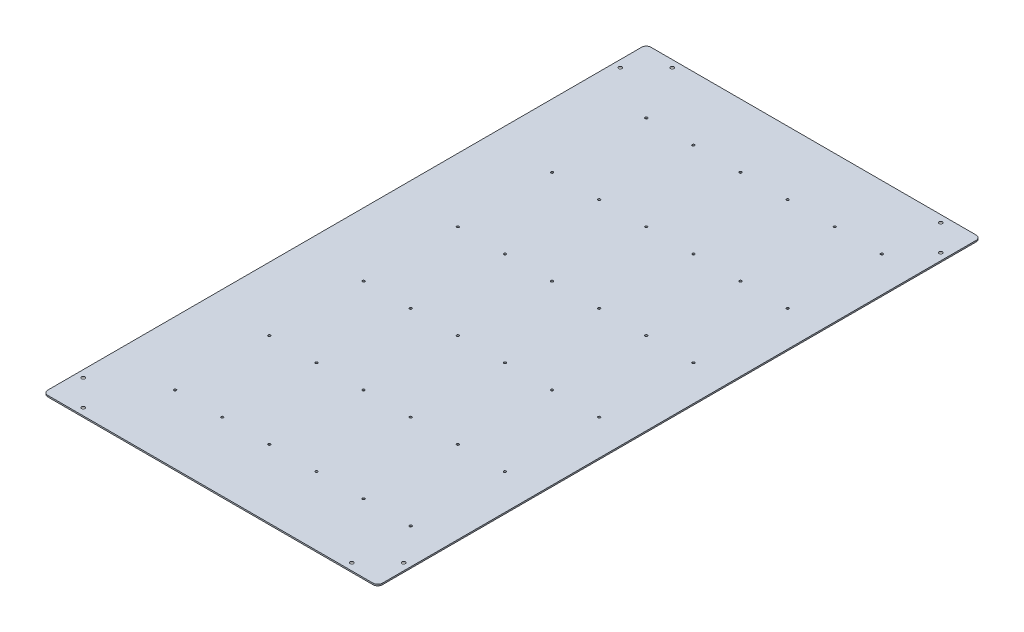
SolidWorks part; units mm, degrees
ref_plane "前视基准面" through (0, 0, 0) normal (0, 0, 1) x (1, 0, 0)
ref_plane "上视基准面" through (0, 0, 0) normal (0, 1, 0) x (1, 0, 0)
ref_plane "右视基准面" through (0, 0, 0) normal (1, 0, 0) x (0, 0, -1)
other "Configuration Table"
sketch "草图1" plane through (0, 0, 0) normal (0, 1, 0) x (1, 0, 0)
  line L1 (-355, 640) -> (355, 640)
  line L2 (-355, 640) -> (-355, -640)
  line L3 (-355, -640) -> (355, -640)
  line L4 (355, 640) -> (355, -640)
  line L5 (-355, 640) -> (355, -640) construction
  line L6 (-355, -640) -> (355, 640) construction
  point P0 (0, 0)
  point P6 (-285, -625)
  point P7 (285, 625)
  point P8 (285, -625)
  point P9 (-340, 570)
  point P10 (-340, -570)
  point P11 (340, -570)
  point P12 (-285, 625)
  point P13 (340, 570)
  point P14 (-220, -495)
  dimension "D15" = 70
  dimension "D1" = 15
  dimension "D2" = 70
  dimension "D3" = 70
  dimension "D4" = 15
  dimension "D5" = 70
  dimension "D6" = 15
  dimension "D7" = 70
  dimension "D8" = 15
  dimension "D9" = 15
  dimension "D10" = 70
  dimension "D11" = 15
  dimension "D12" = 15
  dimension "D13" = 145
  dimension "D14" = 135
  dimension "D16" = 70
  dimension "D17" = 70
  dimension "D18" = 15
extrude "凸台-拉伸1" add sketch "草图1" along normal blind 3
hole_wizard "M6 内六角花形半沉头螺钉的锥形沉头孔1" positions "草图4" profile "草图5" countersink size "M6" standard "GB"
sketch "草图4" plane through (0, 0, 0) normal (0, -1, 0) x (-1, 0, 0)
  point P0 (-285, 625)
  point P3 (-340, 570)
  point P6 (-340, -570)
  point P9 (-285, -625)
  point P12 (285, -625)
  point P15 (340, -570)
  point P18 (340, 570)
  point P21 (285, 625)
sketch "草图5" plane through (285, 0, -625) normal (1, 0, 0) x (0, 0, -1)
  line L0 (0, 0) -> (0, 3)
  line L1 (0, 3) -> (3.5, 3)
  line L2 (3.5, 3) -> (3.5, 2.9)
  line L3 (3.5, 2.9) -> (6.4, 0)
  line L5 (6.4, 0) -> (0, 0)
  line L6 (-3.5, 2.9) -> (-6.4, 0) construction
  line L11 (0, -6.35) -> (0, 107.95) construction
  dimension "通孔孔直径" = 7
  dimension "通孔孔深度" = 3
  dimension "近端锥形沉头孔直径" = 12.8
  dimension "近端锥形沉头孔角度" = 90
hole_wizard "M6 螺纹孔1" positions "草图6" profile "草图7" tap size "M6" standard "GB"
sketch "草图6" plane through (0, 3, 0) normal (0, 1, 0) x (1, 0, 0)
  point P0 (-220, -495)
sketch "草图7" plane through (-220, 3, 495) normal (1, 0, 0) x (0, 0, 1)
  line L0 (0, 0) -> (0, 3)
  line L1 (0, 3) -> (2.5, 3)
  line L2 (2.5, 3) -> (2.5, 0)
  line L5 (2.5, 0) -> (0, 0)
  line L11 (0, -6.35) -> (0, 107.95) construction
  dimension "通孔螺纹孔钻头直径" = 5
  dimension "通孔螺纹孔钻头深度" = 3
pattern_linear "阵列(线性)1" count 6 spacing 200 along (0, 0, -1) count 6 spacing 100 along (1, 0, 0) of "M6 螺纹孔1"
fillet "圆角1" radius 10 4 edges at (-355, 1.5, -640) (355, 1.5, -640) (-355, 1.5, 640) (355, 1.5, 640)
